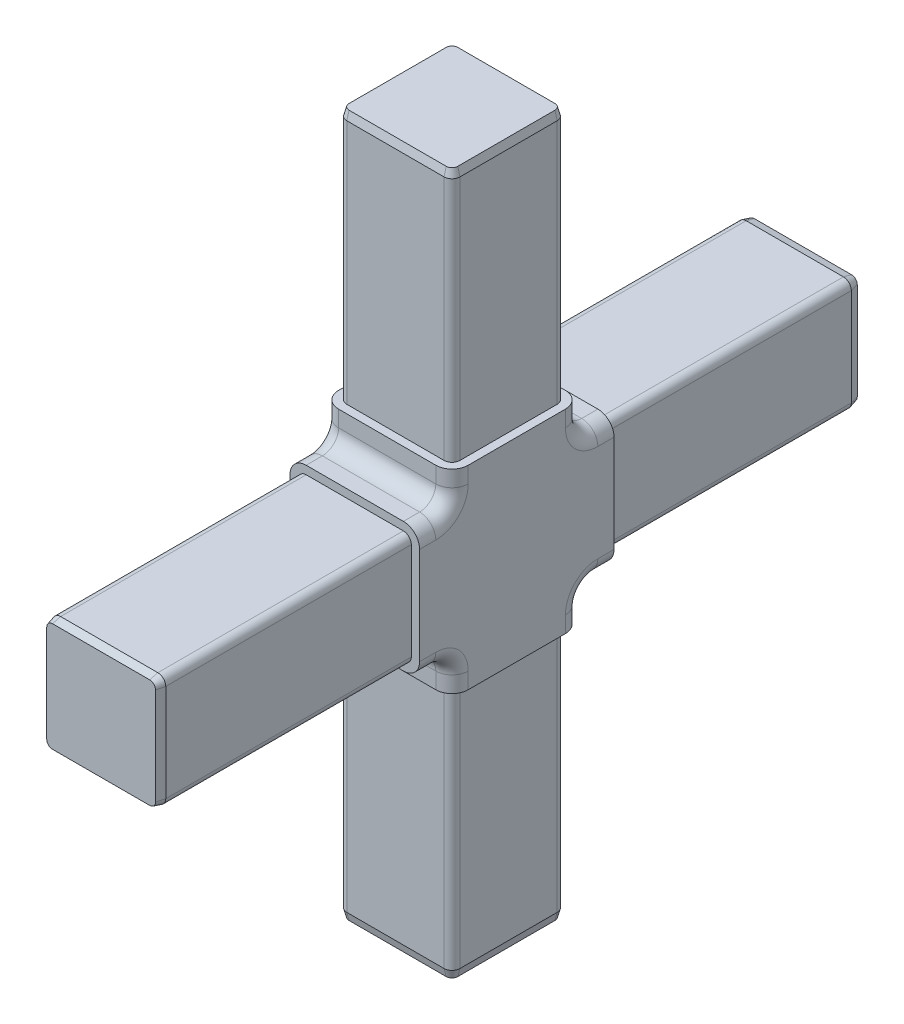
SolidWorks part; units mm, degrees
ref_plane "Front Plane" through (0, 0, 0) normal (1, 0, 0) x (0, 1, 0)
ref_plane "Top Plane" through (0, 0, 0) normal (0, 0, 1) x (0, 1, 0)
ref_plane "Right Plane" through (0, 0, 0) normal (0, 1, 0) x (-1, 0, 0)
sketch "8in Top" plane through (0, 0, 0) normal (0, 0, 1) x (0, 1, 0)
  line B0 (-76.2, -88.9) -> (76.2, -88.9)
  line B1 (-88.9, -76.2) -> (-88.9, 76.2)
  line B2 (76.2, 88.9) -> (-76.2, 88.9)
  line B3 (88.9, 76.2) -> (88.9, -76.2)
  line B4 (-76.2, -101.6) -> (76.2, -101.6)
  line B5 (-101.6, -76.2) -> (-101.6, 76.2)
  line B6 (76.2, 101.6) -> (-76.2, 101.6)
  line B7 (101.6, 76.2) -> (101.6, -76.2)
  arc B8 (101.6, 76.2) -> (76.2, 101.6) centre (76.2, 76.2) ccw
  arc B9 (76.2, -101.6) -> (101.6, -76.2) centre (76.2, -76.2) ccw
  arc B10 (-101.6, -76.2) -> (-76.2, -101.6) centre (-76.2, -76.2) ccw
  arc B11 (-76.2, 101.6) -> (-101.6, 76.2) centre (-76.2, 76.2) ccw
  arc B12 (-76.2, 88.9) -> (-88.9, 76.2) centre (-76.2, 76.2) ccw
  arc B13 (88.9, 76.2) -> (76.2, 88.9) centre (76.2, 76.2) ccw
  arc B14 (76.2, -88.9) -> (88.9, -76.2) centre (76.2, -76.2) ccw
  arc B15 (-88.9, -76.2) -> (-76.2, -88.9) centre (-76.2, -76.2) ccw
  line B16 (-76.2, 76.2) -> (76.2, -76.2) construction
sketch_block_instance "8x8x0.5-1"
sketch_block "8x8x0.5" parameters "D1"=25.4, "D2"=12.7, "D3"=12.7, "D4"=12.7, "D5"=203.2, "D6"=203.2, "D7"=177.8, "D8"=177.8
sketch "8in Right" plane through (0, 0, 0) normal (0, 1, 0) x (-1, 0, 0)
  line B0 (-76.2, -88.9) -> (76.2, -88.9)
  line B1 (-88.9, -76.2) -> (-88.9, 76.2)
  line B2 (76.2, 88.9) -> (-76.2, 88.9)
  line B3 (88.9, 76.2) -> (88.9, -76.2)
  line B4 (-76.2, -101.6) -> (76.2, -101.6)
  line B5 (-101.6, -76.2) -> (-101.6, 76.2)
  line B6 (76.2, 101.6) -> (-76.2, 101.6)
  line B7 (101.6, 76.2) -> (101.6, -76.2)
  arc B8 (101.6, 76.2) -> (76.2, 101.6) centre (76.2, 76.2) ccw
  arc B9 (76.2, -101.6) -> (101.6, -76.2) centre (76.2, -76.2) ccw
  arc B10 (-101.6, -76.2) -> (-76.2, -101.6) centre (-76.2, -76.2) ccw
  arc B11 (-76.2, 101.6) -> (-101.6, 76.2) centre (-76.2, 76.2) ccw
  arc B12 (-76.2, 88.9) -> (-88.9, 76.2) centre (-76.2, 76.2) ccw
  arc B13 (88.9, 76.2) -> (76.2, 88.9) centre (76.2, 76.2) ccw
  arc B14 (76.2, -88.9) -> (88.9, -76.2) centre (76.2, -76.2) ccw
  arc B15 (-88.9, -76.2) -> (-76.2, -88.9) centre (-76.2, -76.2) ccw
  line B16 (-76.2, 76.2) -> (76.2, -76.2) construction
sketch_block_instance "8x8x0.5-2"
sketch "Sketch5" plane through (0, 0, 0) normal (0, 0, 1) x (0, 1, 0)
  line L0 (76.2, 101.6) -> (-76.2, 101.6) construction
  line L1 (-101.6, 101.6) -> (101.6, 101.6)
  line L2 (-101.6, 101.6) -> (-101.6, -101.6)
  line L3 (-101.6, -101.6) -> (101.6, -101.6)
  line L4 (101.6, 101.6) -> (101.6, -101.6)
  line L5 (-101.6, 101.6) -> (101.6, -101.6) construction
  line L6 (-101.6, -101.6) -> (101.6, 101.6) construction
  line L7 (101.6, 76.2) -> (101.6, -76.2) construction
  point P0 (0, 0)
extrude "Boss-Extrude1" add sketch "Sketch5" along normal mid plane 1100
sketch "Sketch6" plane through (0, 0, 0) normal (0, 1, 0) x (-1, 0, 0)
  line L0 (76.2, 101.6) -> (-76.2, 101.6) construction
  line L1 (-101.6, 101.6) -> (101.6, 101.6)
  line L2 (-101.6, 101.6) -> (-101.6, -101.6)
  line L3 (-101.6, -101.6) -> (101.6, -101.6)
  line L4 (101.6, 101.6) -> (101.6, -101.6)
  line L5 (-101.6, 101.6) -> (101.6, -101.6) construction
  line L6 (-101.6, -101.6) -> (101.6, 101.6) construction
  line L7 (101.6, 76.2) -> (101.6, -76.2) construction
  point P0 (0, 0)
extrude "Boss-Extrude2" add sketch "Sketch6" along normal mid plane 1100
ref_plane "Plane1" through (0, 152.4, 0) normal (0, 1, 0) x (-1, 0, 0)
ref_plane "Plane2" through (0, -152.4, 0) normal (0, 1, 0) x (-1, 0, 0)
sketch "Sketch7" plane through (0, 152.4, 0) normal (0, 1, 0) x (-1, 0, 0)
  line L5 (-188.9423, 141.7779) -> (188.9423, 141.7779)
  line L6 (-188.9423, 141.7779) -> (-188.9423, -141.7779)
  line L7 (-188.9423, -141.7779) -> (188.9423, -141.7779)
  line L8 (-88.646, 76.2) -> (-88.646, -76.2)
  line L9 (-76.2, -88.646) -> (76.2, -88.646)
  line L10 (88.646, -76.2) -> (88.646, 76.2)
  line L11 (76.2, 88.646) -> (-76.2, 88.646)
  line L12 (-88.646, 76.2) -> (-88.646, -76.2)
  line L13 (-76.2, -88.646) -> (76.2, -88.646)
  line L14 (88.646, -76.2) -> (88.646, 76.2)
  line L15 (76.2, 88.646) -> (-76.2, 88.646)
  line L16 (188.9423, 141.7779) -> (188.9423, -141.7779)
  line L17 (-188.9423, 141.7779) -> (188.9423, -141.7779) construction
  line L18 (-188.9423, -141.7779) -> (188.9423, 141.7779) construction
  arc A8 (-76.2, 88.646) -> (-88.646, 76.2) centre (-76.2, 76.2) ccw
  arc A9 (-88.646, -76.2) -> (-76.2, -88.646) centre (-76.2, -76.2) ccw
  arc A10 (76.2, -88.646) -> (88.646, -76.2) centre (76.2, -76.2) ccw
  arc A11 (88.646, 76.2) -> (76.2, 88.646) centre (76.2, 76.2) ccw
  arc A12 (-76.2, 88.646) -> (-88.646, 76.2) centre (-76.2, 76.2) ccw
  arc A13 (-88.646, -76.2) -> (-76.2, -88.646) centre (-76.2, -76.2) ccw
  arc A14 (76.2, -88.646) -> (88.646, -76.2) centre (76.2, -76.2) ccw
  arc A15 (88.646, 76.2) -> (76.2, 88.646) centre (76.2, 76.2) ccw
  point P0 (0, 0)
  dimension "D1" = 0.254
sketch "Sketch8" plane through (0, -152.4, 0) normal (0, 1, 0) x (-1, 0, 0)
  line L5 (-166.8077, 169.5868) -> (166.8077, 169.5868)
  line L6 (-166.8077, 169.5868) -> (-166.8077, -169.5868)
  line L7 (-166.8077, -169.5868) -> (166.8077, -169.5868)
  line L8 (88.646, -76.2) -> (88.646, 76.2)
  line L9 (-76.2, -88.646) -> (76.2, -88.646)
  line L10 (-88.646, 76.2) -> (-88.646, -76.2)
  line L11 (76.2, 88.646) -> (-76.2, 88.646)
  line L12 (88.646, -76.2) -> (88.646, 76.2)
  line L13 (-76.2, -88.646) -> (76.2, -88.646)
  line L14 (-88.646, 76.2) -> (-88.646, -76.2)
  line L15 (76.2, 88.646) -> (-76.2, 88.646)
  line L16 (166.8077, 169.5868) -> (166.8077, -169.5868)
  line L17 (-166.8077, 169.5868) -> (166.8077, -169.5868) construction
  line L18 (-166.8077, -169.5868) -> (166.8077, 169.5868) construction
  arc A8 (88.646, 76.2) -> (76.2, 88.646) centre (76.2, 76.2) ccw
  arc A9 (76.2, -88.646) -> (88.646, -76.2) centre (76.2, -76.2) ccw
  arc A10 (-88.646, -76.2) -> (-76.2, -88.646) centre (-76.2, -76.2) ccw
  arc A11 (-76.2, 88.646) -> (-88.646, 76.2) centre (-76.2, 76.2) ccw
  arc A12 (88.646, 76.2) -> (76.2, 88.646) centre (76.2, 76.2) ccw
  arc A13 (76.2, -88.646) -> (88.646, -76.2) centre (76.2, -76.2) ccw
  arc A14 (-88.646, -76.2) -> (-76.2, -88.646) centre (-76.2, -76.2) ccw
  arc A15 (-76.2, 88.646) -> (-88.646, 76.2) centre (-76.2, 76.2) ccw
  point P0 (0, 0)
  dimension "D1" = 0.254
extrude "Cut-Extrude1" cut sketch "Sketch7" along normal through all
extrude "Cut-Extrude2" cut sketch "Sketch8" against normal through all
ref_plane "Plane3" through (0, 0, 152.4) normal (0, 0, 1) x (0, 1, 0)
ref_plane "Plane4" through (0, 0, -152.4) normal (0, 0, 1) x (0, 1, 0)
sketch "Sketch9" plane through (0, 0, 152.4) normal (0, 0, 1) x (0, 1, 0)
  line L5 (-183.8127, 241.9352) -> (183.8127, 241.9352)
  line L6 (-183.8127, 241.9352) -> (-183.8127, -241.9352)
  line L7 (-183.8127, -241.9352) -> (183.8127, -241.9352)
  line L8 (-88.646, 76.2) -> (-88.646, -76.2)
  line L9 (-76.2, -88.646) -> (76.2, -88.646)
  line L10 (88.646, -76.2) -> (88.646, 76.2)
  line L11 (76.2, 88.646) -> (-76.2, 88.646)
  line L12 (-88.646, 76.2) -> (-88.646, -76.2)
  line L13 (-76.2, -88.646) -> (76.2, -88.646)
  line L14 (88.646, -76.2) -> (88.646, 76.2)
  line L15 (76.2, 88.646) -> (-76.2, 88.646)
  line L16 (183.8127, 241.9352) -> (183.8127, -241.9352)
  line L17 (-183.8127, 241.9352) -> (183.8127, -241.9352) construction
  line L18 (-183.8127, -241.9352) -> (183.8127, 241.9352) construction
  arc A8 (-76.2, 88.646) -> (-88.646, 76.2) centre (-76.2, 76.2) ccw
  arc A9 (-88.646, -76.2) -> (-76.2, -88.646) centre (-76.2, -76.2) ccw
  arc A10 (76.2, -88.646) -> (88.646, -76.2) centre (76.2, -76.2) ccw
  arc A11 (88.646, 76.2) -> (76.2, 88.646) centre (76.2, 76.2) ccw
  arc A12 (-76.2, 88.646) -> (-88.646, 76.2) centre (-76.2, 76.2) ccw
  arc A13 (-88.646, -76.2) -> (-76.2, -88.646) centre (-76.2, -76.2) ccw
  arc A14 (76.2, -88.646) -> (88.646, -76.2) centre (76.2, -76.2) ccw
  arc A15 (88.646, 76.2) -> (76.2, 88.646) centre (76.2, 76.2) ccw
  point P0 (0, 0)
  dimension "D1" = 0.254
sketch "Sketch10" plane through (0, 0, -152.4) normal (0, 0, 1) x (0, 1, 0)
  line L5 (-154.7514, 180.9065) -> (154.7514, 180.9065)
  line L6 (-154.7514, 180.9065) -> (-154.7514, -180.9065)
  line L7 (-154.7514, -180.9065) -> (154.7514, -180.9065)
  line L8 (-76.2, -88.646) -> (76.2, -88.646)
  line L9 (-88.646, 76.2) -> (-88.646, -76.2)
  line L10 (76.2, 88.646) -> (-76.2, 88.646)
  line L11 (88.646, -76.2) -> (88.646, 76.2)
  line L12 (-76.2, -88.646) -> (76.2, -88.646)
  line L13 (-88.646, 76.2) -> (-88.646, -76.2)
  line L14 (76.2, 88.646) -> (-76.2, 88.646)
  line L15 (88.646, -76.2) -> (88.646, 76.2)
  line L16 (154.7514, 180.9065) -> (154.7514, -180.9065)
  line L17 (-154.7514, 180.9065) -> (154.7514, -180.9065) construction
  line L18 (-154.7514, -180.9065) -> (154.7514, 180.9065) construction
  arc A8 (76.2, -88.646) -> (88.646, -76.2) centre (76.2, -76.2) ccw
  arc A9 (-88.646, -76.2) -> (-76.2, -88.646) centre (-76.2, -76.2) ccw
  arc A10 (-76.2, 88.646) -> (-88.646, 76.2) centre (-76.2, 76.2) ccw
  arc A11 (88.646, 76.2) -> (76.2, 88.646) centre (76.2, 76.2) ccw
  arc A12 (76.2, -88.646) -> (88.646, -76.2) centre (76.2, -76.2) ccw
  arc A13 (-88.646, -76.2) -> (-76.2, -88.646) centre (-76.2, -76.2) ccw
  arc A14 (-76.2, 88.646) -> (-88.646, 76.2) centre (-76.2, 76.2) ccw
  arc A15 (88.646, 76.2) -> (76.2, 88.646) centre (76.2, 76.2) ccw
  point P0 (0, 0)
  dimension "D1" = 0.254
extrude "Cut-Extrude3" cut sketch "Sketch9" along normal through all
extrude "Cut-Extrude4" cut sketch "Sketch10" against normal through all
fillet "Fillet1" radius 25.4 20 edges at (-101.6, -101.6, -127) (-101.6, 101.6, 127) (-101.6, -101.6, 127) (0, 101.6, -101.6) (-101.6, 101.6, -127) (-101.6, 127, -101.6) (-101.6, -127, -101.6) (-101.6, 127, 101.6) (-101.6, -127, 101.6) (0, -101.6, -101.6) (101.6, -127, -101.6) (101.6, -101.6, -127) (101.6, 101.6, -127) (101.6, 127, -101.6) (0, 101.6, 101.6) (101.6, 127, 101.6) (101.6, 101.6, 127) (0, -101.6, 101.6) (101.6, -127, 101.6) (101.6, -101.6, 127)
chamfer "Chamfer1" distance 12.7 angle 15 16 edges at (-88.646, 0, 550) (-85.0007, 85.0007, 550) (0, 88.646, 550) (85.0007, 85.0007, 550) (88.646, 0, 550) (85.0007, -85.0007, 550) (0, -88.646, 550) (-85.0007, -85.0007, 550) (85.0007, 550, -85.0007) (0, 550, -88.646) (-85.0007, 550, -85.0007) (-88.646, 550, 0) (-85.0007, 550, 85.0007) (0, 550, 88.646) (85.0007, 550, 85.0007) (88.646, 550, 0)
chamfer "Chamfer2" distance 12.7 angle 15 16 edges at (0, 88.646, -550) (-85.0007, 85.0007, -550) (-88.646, 0, -550) (-85.0007, -85.0007, -550) (0, -88.646, -550) (85.0007, -85.0007, -550) (88.646, 0, -550) (85.0007, 85.0007, -550) (0, -550, 88.646) (85.0007, -550, 85.0007) (88.646, -550, 0) (85.0007, -550, -85.0007) (0, -550, -88.646) (-85.0007, -550, -85.0007) (-88.646, -550, 0) (-85.0007, -550, 85.0007)
